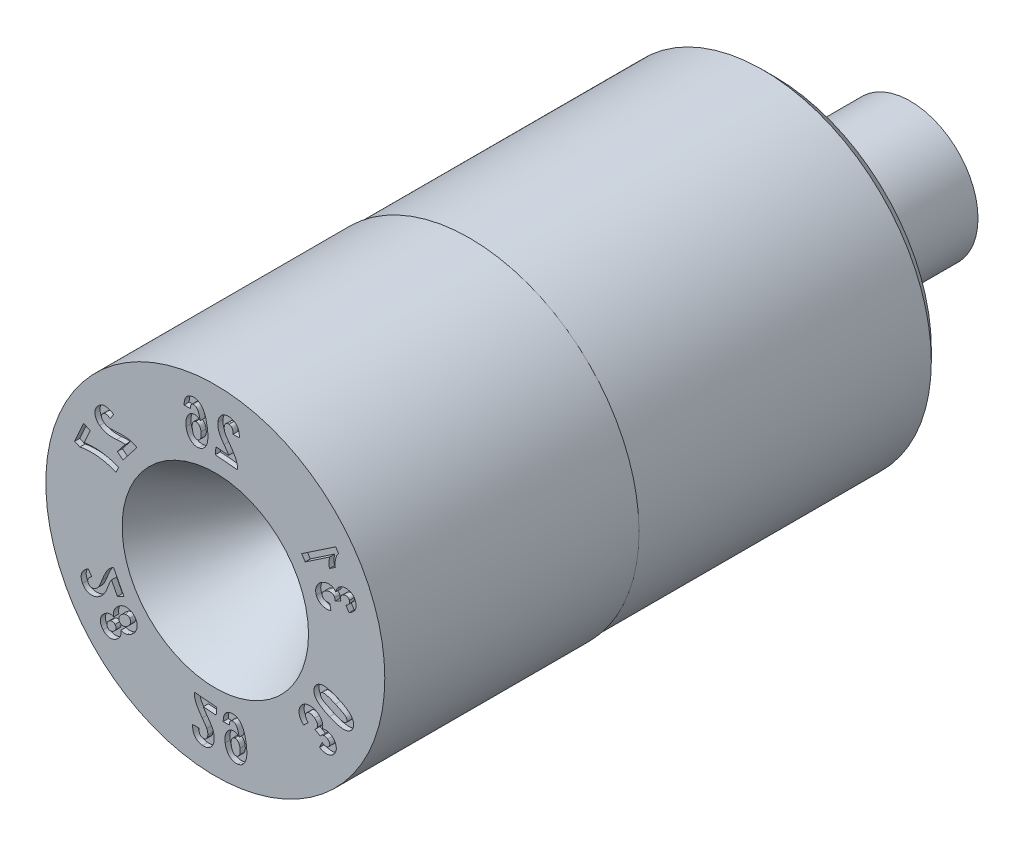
SolidWorks part; units mm, degrees
other "<M8L16-SetScrew>-<Chamfer1>"
ref_plane "Front Plane" through (0, 0, 0) normal (0, 0, 1) x (1, 0, 0)
ref_plane "Top Plane" through (0, 0, 0) normal (0, 1, 0) x (1, 0, 0)
ref_plane "Right Plane" through (0, 0, 0) normal (1, 0, 0) x (0, 0, -1)
sketch "Sketch1" plane through (0, 0, 0) normal (1, 0, 0) x (0, 0, -1)
  line L0 (0, 5.5) -> (6.4952, 1.75)
  line L2 (0, 10) -> (0, 5.5)
  line L3 (32.2458, 10) -> (0, 10)
  line L4 (-3.7979, 0) -> (49996.2021, 0) construction
  line L8 (25, 1.75) -> (6.4952, 1.75)
  line L12 (33, 4) -> (33, 9.2457)
  line L16 (33, 9.2457) -> (32.2458, 10)
  line L17 (33, 4) -> (25, 4)
  line L18 (25, 1.75) -> (25, 4)
  dimension "D1" = 33
  dimension "D2" = 45
  dimension "D3" = 0.7542
  dimension "D4" = 20
  dimension "D5" = 30
  dimension "D6" = 5.5
  dimension "D7" = 3.5
  dimension "D8" = 8
  dimension "D9" = 8
revolve "Revolve1" add sketch "Sketch1" angle 360 about L4
sketch "Sketch5" plane through (0, 0, 0) normal (1, 0, 0) x (0, 0, -1)
  line L0 (0, 0) -> (50000, 0) construction
  line L1 (0, 10) -> (0, -10) construction
  line L2 (15, 9.935) -> (33, 9.935)
  line L3 (15, 9.935) -> (15, 10.935)
  line L4 (15, 10.935) -> (33, 10.935)
  line L5 (33, 9.935) -> (33, 10.935)
  line L6 (33, -9.2457) -> (33, 9.2457) construction
  line L7 (32.2458, 10) -> (0, 10) construction
  dimension "D1" = 15
  dimension "D2" = 0.065
  dimension "D3" = 1
revolve "Cut-Revolve1" cut sketch "Sketch5" angle 360 about L0
sketch "Sketch2" plane through (0, 0, 0) normal (0, 0, 1) x (1, 0, 0)
  line L0 (0, 0) -> (0, 10) construction
  line L1 (0, 0) -> (8.6603, 5) construction
  line L2 (0, 0) -> (8.6603, -5) construction
  line L3 (0, 0) -> (0, -10) construction
  line L4 (0, 0) -> (-8.6603, -5) construction
  line L5 (0, 0) -> (-8.6603, 5) construction
  arc A0 (1.3857, 6.2994) -> (3.1694, 5.6176) centre (0, 0) ccw construction
  circle A1 centre (0, 0) radius 10 construction
  text T0 "26    27     28    29    30    31" font "Arial Narrow" height 2.4
  point P18 (0, 0)
  dimension "D1" = 12.9
  dimension "D2" = 6
extrude "Cut-Extrude1" cut sketch "Sketch2" against normal blind 0.3
ref_plane "Plane1" through (0, 0, -6.4952) normal (0, 0, 1) x (1, 0, 0)
sketch "Sketch6" plane through (0, 0, -6.4952) normal (0, 0, 1) x (1, 0, 0)
  line L1 (2.0207, 0) -> (1.0104, 1.75)
  line L2 (1.0104, 1.75) -> (-1.0104, 1.75)
  line L3 (-1.0104, 1.75) -> (-2.0207, 0)
  line L4 (-2.0207, 0) -> (-1.0104, -1.75)
  line L5 (-1.0104, -1.75) -> (1.0104, -1.75)
  line L6 (1.0104, -1.75) -> (2.0207, 0)
  circle A0 centre (0, 0) radius 1.75 construction
  circle A1 centre (0, 0) radius 1.75 construction
  point P1 (0, 1.75)
extrude "Cut-Extrude2" cut sketch "Sketch6" against normal blind 3.5 contours L3 L4 L5 L6 L1 L2
inserted part "M8L16-SetScrew"
move or copy body "Body-Move/Copy2" placed by mates yes
other "Distance1" parameters "D1"=8
